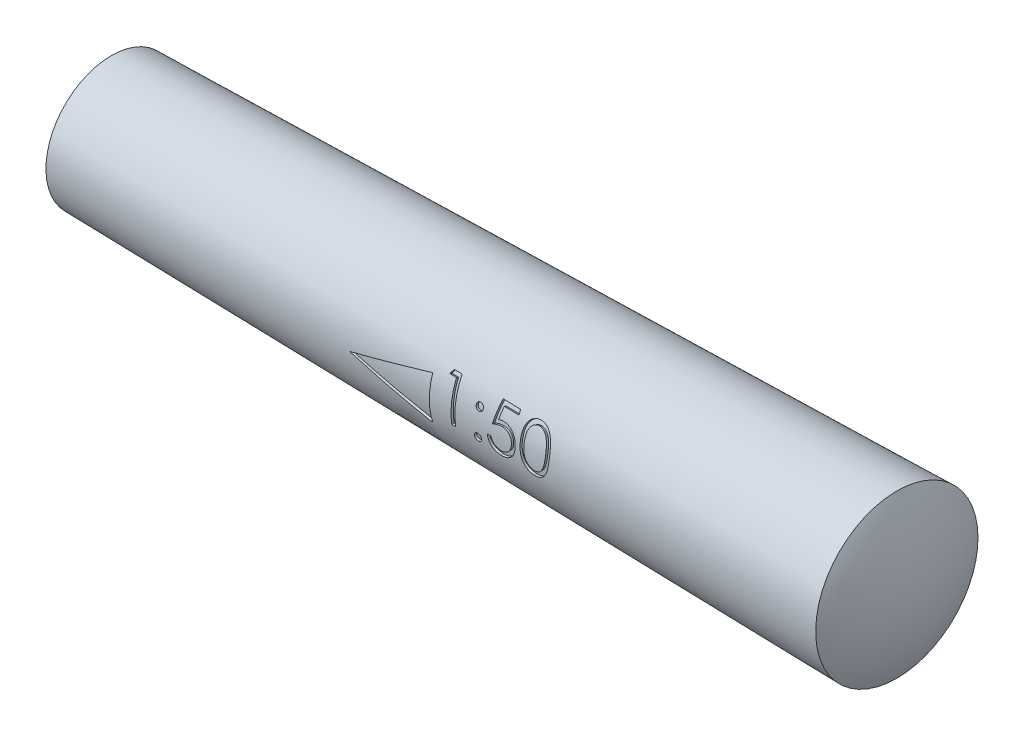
SolidWorks part; units mm, degrees
ref_plane "Front Plane" through (0, 0, 0) normal (0, 0, 1) x (1, 0, 0)
ref_plane "Top Plane" through (0, 0, 0) normal (0, 1, 0) x (1, 0, 0)
ref_plane "Right Plane" through (0, 0, 0) normal (1, 0, 0) x (0, 0, -1)
sketch "Sketch1" plane through (0, 0, 0) normal (1, 0, 0) x (0, 0, -1)
  circle A0 centre (0, 0) radius 1.5
  dimension "D1" = 3
extrude "Extrude1" add sketch "Sketch1" along normal mid plane 18
draft "Draft1" type of draft neutral plane draft angle 1.146 faces to draft 1 parameters "D1"=1.146
sketch "Sketch2" plane through (0, 0, 0) normal (0, 0, 1) x (1, 0, 0)
  line L0 (-9, 0) -> (-9, 1.5)
  line L1 (-9, 1.5) -> (-9, -1.5) construction
  line L2 (-9, 0) -> (-9.45, 0)
  line L3 (-9.45, 0) -> (-9.45, -1.68) construction
  line L4 (9, 0) -> (9, 1.86)
  line L5 (9, -1.86) -> (9, 1.86) construction
  line L6 (9, 0) -> (9.45, 0)
  line L7 (9.45, 0) -> (9.45, -1.68) construction
  line L8 (-9, -1.5) -> (9, -1.86) construction
  arc A0 (-9.45, 0) -> (-9, 1.5) centre (-6.725, 0) cw
  arc A1 (9.45, 0) -> (9, 1.86) centre (5.381, 0) ccw
  point P14 (0, -1.68)
revolve "Revolve1" add sketch "Sketch2" angle 360 about L2
sketch "Sketch5" plane through (0, 0, 0) normal (0, 0, 1) x (1, 0, 0)
  line L0 (0, 1.68) -> (0, -1.68) construction
  line L1 (9, 1.86) -> (-9, 1.5) construction
  line L2 (-9, -1.5) -> (9, -1.86) construction
ref_plane "Plane2" through (0, 0, 0) normal (-0.02, 0, 0.9998) x (0.9998, 0, 0.02)
sketch "Sketch6" plane through (0, 0, 0) normal (-0.02, 0, 0.9998) x (0.9998, 0, 0.02)
  line L0 (0, 0) -> (0, 0.5)
  line L1 (0, 1.68) -> (0, -1.68) construction
  line L2 (0, 0.5) -> (-1.866, 0)
  line L3 (-1.866, 0) -> (0, -0.5)
  line L4 (0, -0.5) -> (0, 0)
  line L5 (0, -0.25) -> (3, -0.25) construction
  text T0 "1:50" font "Century Gothic" height 1
  dimension "D1" = 1
  dimension "D2" = 30
  dimension "D3" = 3
wrap "Wrap2" sketch "Sketch6" wrap type deboss source sketch "Sketch6" thickness 0.05 parameters "D1"=0.05
equation "\"D2@Sketch2\" = \"D1@Sketch2\""
